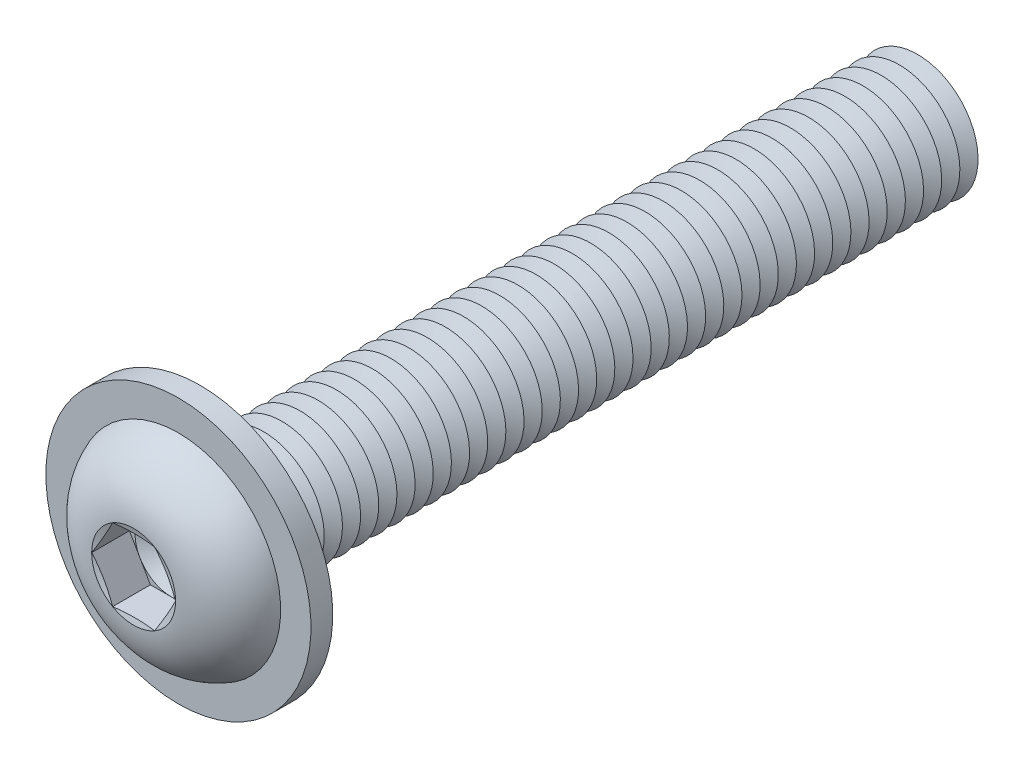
SolidWorks part; units mm, degrees
ref_plane "Front Plane" through (0, 0, 0) normal (0, 0, 1) x (1, 0, 0)
ref_plane "Top Plane" through (0, 0, 0) normal (0, 1, 0) x (1, 0, 0)
ref_plane "Right Plane" through (0, 0, 0) normal (1, 0, 0) x (0, 0, -1)
sketch "Sketch1" plane through (0, 0, 0) normal (1, 0, 0) x (0, 0, -1)
  line L0 (0, 5) -> (0, 8.75)
  line L3 (0, 5) -> (60, 5)
  line L4 (60, 5) -> (60, 0)
  line L5 (60, 0) -> (-5.5, 0) construction
  line L6 (-5.5, 0) -> (60, 0)
  line L7 (-5.5, 3.4641) -> (-5.5, 1.732) construction
  line L8 (-5.5, 1.732) -> (-5.5, 0)
  line L9 (-5.5, 3.4641) -> (-5.0359, 1.732)
  line L10 (-5.0359, 1.732) -> (-5.5, 1.732)
  line L11 (60, 0) -> (22.7481, 0) construction
  line L12 (0, 8.75) -> (-5.5, 8.75) construction
  arc A1 (0, 8.75) -> (-5.5, 3.4641) centre (0, 3.2457) ccw
  point P8 (60, 2.5)
  dimension "D1" = 17.5
  dimension "D2" = 10
  dimension "D3" = 5.5
  dimension "D4" = 6.9282
  dimension "D5" = 60
  dimension "D6" = 15
revolve "Revolve1" add sketch "Sketch1" angle 360 about L5
fillet "Fillet1" radius 0.75 1 edges at (0, 5, 0)
sketch "Sketch2" plane through (0, 0, 0) normal (1, 0, 0) x (0, 0, -1)
  line L0 (59.25, 5) -> (60.75, 5)
  line L1 (60, 5) -> (0.75, 5) construction
  line L2 (60.75, 5) -> (60, 3.701)
  line L3 (60, -5) -> (60, 5) construction
  line L4 (60, 3.701) -> (59.25, 5)
  dimension "D1" = 1.5
revolve "Cut-Revolve1" cut sketch "Sketch2" angle 360 about axis through (0, 0, -60) along (0, 0, -1)
pattern_linear "LPattern1" count 40 spacing 1.5 along (0, 0, 1) of "Cut-Revolve1"
sketch "Sketch3" plane through (0, 0, 5.5) normal (0, 0, 1) x (1, 0, 0)
  line L7 (1.732, 3) -> (-1.7321, 3)
  line L8 (-1.7321, 3) -> (-3.4641, 0)
  line L9 (-3.4641, 0) -> (-1.732, -3)
  line L10 (-1.732, -3) -> (1.732, -3)
  line L11 (1.732, -3) -> (3.4641, 0)
  line L12 (3.4641, 0) -> (1.732, 3)
  circle A0 centre (0, 0) radius 3 construction
  circle A3 centre (0, 0) radius 3.4641 construction
extrude "Cut-Extrude1" cut sketch "Sketch3" against normal blind 3.12
sketch "Sketch4" plane through (0, 0, 2.38) normal (0, 0, 1) x (1, 0, 0)
  line L1 (1.732, 3) -> (-1.7321, 3) construction
  circle A0 centre (0, 0) radius 3
extrude "Cut-Extrude2" cut sketch "Sketch4" against normal through all draft 60
sketch "Sketch5" plane through (0, 0, 0) normal (0, 0, -1) x (-1, 0, 0)
  circle A0 centre (0, 0) radius 10.95
  circle A1 centre (0, 0) radius 5.75
  circle A2 centre (0, 0) radius 5.75 construction
  dimension "D1" = 21.9
extrude "Boss-Extrude1" add sketch "Sketch5" against normal blind 1.8
